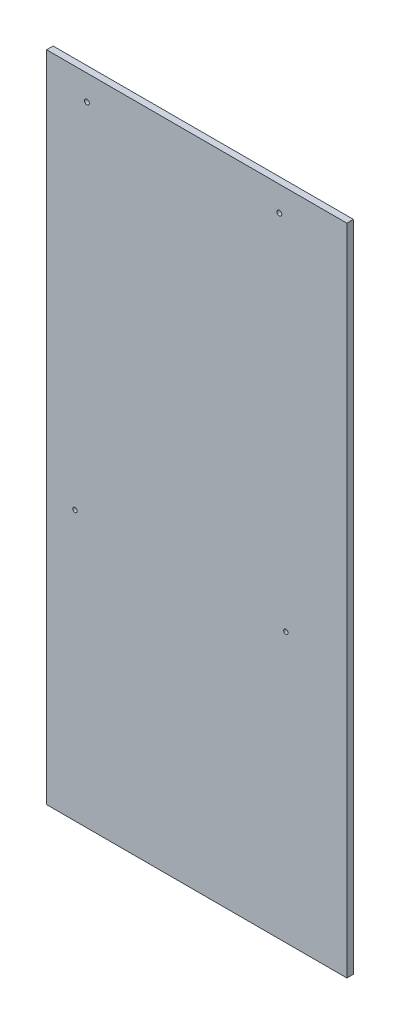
SolidWorks part; units mm, degrees
ref_plane "Front Plane" through (0, 0, 0) normal (0, 0, 1) x (1, 0, 0)
ref_plane "Top Plane" through (0, 0, 0) normal (0, 1, 0) x (1, 0, 0)
ref_plane "Right Plane" through (0, 0, 0) normal (1, 0, 0) x (0, 0, -1)
sketch "Sketch2" plane through (0, 0, 0) normal (0, 0, 1) x (1, 0, 0)
  line L1 (-175.006, -381) -> (175.006, -381)
  line L2 (-175.006, -381) -> (-175.006, 381)
  line L3 (-175.006, 381) -> (175.006, 381)
  line L4 (175.006, -381) -> (175.006, 381)
  line L5 (-175.006, -381) -> (175.006, 381) construction
  line L6 (-175.006, 381) -> (175.006, -381) construction
  point P0 (0, 0)
  dimension "D1" = 350.012
  dimension "D2" = 762
extrude "Boss-Extrude2" add sketch "Sketch2" along normal blind 7.62
sketch "Sketch3" plane through (0, 0, 7.62) normal (0, 0, 1) x (1, 0, 0)
  line L0 (-175.006, 351.79) -> (175.006, 351.79) construction
  line L1 (-175.006, 381) -> (-175.006, -381) construction
  line L2 (175.006, -381) -> (175.006, 381) construction
  line L3 (175.006, 381) -> (-175.006, 381) construction
  circle A0 centre (-128.016, 351.79) radius 2.8575
  circle A1 centre (96.266, 351.79) radius 2.8575
  dimension "D1" = 5.715
  dimension "D2" = 5.715
  dimension "D3" = 46.99
  dimension "D4" = 78.74
  dimension "D5" = 29.21
extrude "Cut-Extrude1" cut sketch "Sketch3" against normal blind 7.62
sketch "Sketch4" plane through (0, 0, 7.62) normal (0, 0, 1) x (1, 0, 0)
  line L0 (-175.006, -381) -> (175.006, -381) construction
  line L1 (-175.006, 381) -> (-175.006, -381) construction
  circle A0 centre (-141.986, -67.056) radius 2.54
  dimension "D1" = 313.944
  dimension "D2" = 5.08
  dimension "D3" = 33.02
extrude "Cut-Extrude2" cut sketch "Sketch4" against normal through all
sketch "Sketch5" plane through (0, 0, 7.62) normal (0, 0, 1) x (1, 0, 0)
  line L0 (-175.006, -381) -> (175.006, -381) construction
  line L1 (175.006, -381) -> (175.006, 381) construction
  circle A0 centre (103.886, -67.056) radius 2.54
  dimension "D1" = 5.08
  dimension "D2" = 313.944
  dimension "D3" = 71.12
extrude "Cut-Extrude3" cut sketch "Sketch5" against normal through all
